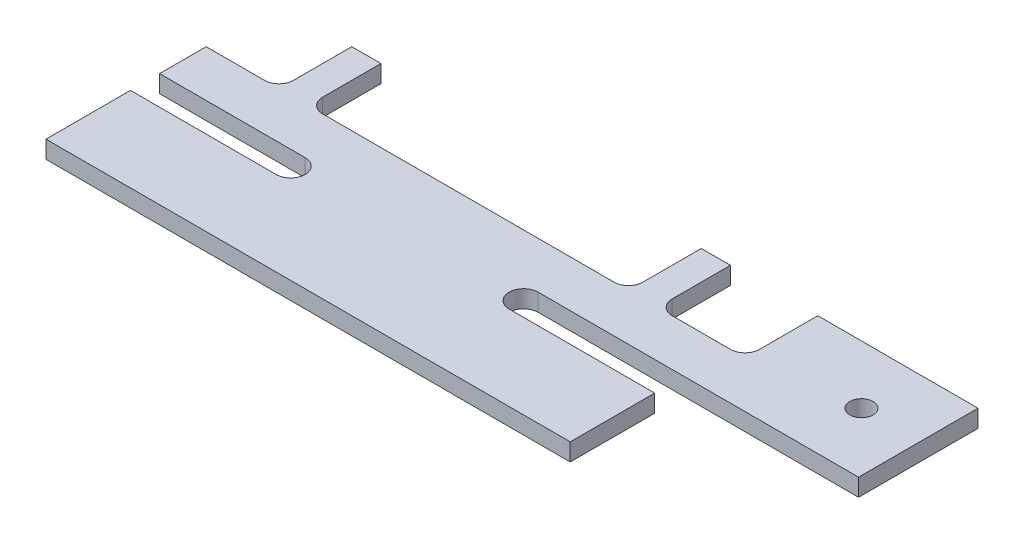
SolidWorks part; units mm, degrees
ref_plane "Front" through (0, 0, 0) normal (0, 0, 1) x (1, 0, 0)
ref_plane "Top" through (0, 0, 0) normal (0, 1, 0) x (1, 0, 0)
ref_plane "Right" through (0, 0, 0) normal (1, 0, 0) x (0, 0, -1)
sketch "Sketch1" plane through (0, 0, 0) normal (0, 1, 0) x (1, 0, 0)
  line L0 (90, 0) -> (90, 14.5)
  line L1 (0, 0) -> (90, 0)
  line L2 (0, 0) -> (0, 14.5)
  line L3 (12.5, 40) -> (17.5, 40)
  line L4 (120, 19.5) -> (120, 40)
  line L5 (0, 19.5) -> (0, 27.5)
  line L6 (0, 0) -> (0, 40) construction
  line L7 (0, 27.5) -> (10, 27.5)
  line L8 (0, 14.5) -> (25, 14.5)
  line L9 (0, 19.5) -> (25, 19.5)
  line L10 (90, 0) -> (90, 40) construction
  line L11 (65, 14.5) -> (90, 14.5)
  line L12 (12.5, 30) -> (12.5, 40)
  line L13 (72.5, 30) -> (72.5, 40)
  line L14 (17.5, 30) -> (17.5, 40)
  line L15 (77.5, 30) -> (77.5, 40)
  line L16 (92.5, 30) -> (92.5, 40)
  line L17 (0, 19.5) -> (0, 40) construction
  line L18 (0, 40) -> (120, 40) construction
  line L19 (72.5, 40) -> (77.5, 40)
  line L20 (92.5, 40) -> (120, 40)
  line L21 (0, 27.5) -> (120, 27.5) construction
  line L22 (92.5, 19.5) -> (92.5, 40) construction
  line L23 (77.5, 19.5) -> (77.5, 40) construction
  line L24 (72.5, 19.5) -> (72.5, 40) construction
  line L25 (17.5, 19.5) -> (17.5, 40) construction
  line L26 (12.5, 19.5) -> (12.5, 40) construction
  line L27 (20, 27.5) -> (70, 27.5)
  line L28 (80, 27.5) -> (90, 27.5)
  line L29 (65, 19.5) -> (120, 19.5)
  arc A0 (25, 14.5) -> (25, 19.5) centre (25, 17) ccw
  arc A1 (65, 19.5) -> (65, 14.5) centre (65, 17) ccw
  circle A2 centre (110, 30) radius 2
  arc A3 (10, 27.5) -> (12.5, 30) centre (10, 30) ccw
  arc A4 (20, 27.5) -> (17.5, 30) centre (20, 30) cw
  arc A5 (70, 27.5) -> (72.5, 30) centre (70, 30) ccw
  arc A6 (80, 27.5) -> (77.5, 30) centre (80, 30) cw
  arc A7 (92.5, 30) -> (90, 27.5) centre (90, 30) cw
  point P39 (17.5, 27.5)
  point P42 (72.5, 27.5)
  point P45 (77.5, 27.5)
extrude "Extrude1" add sketch "Sketch1" along normal blind 3
